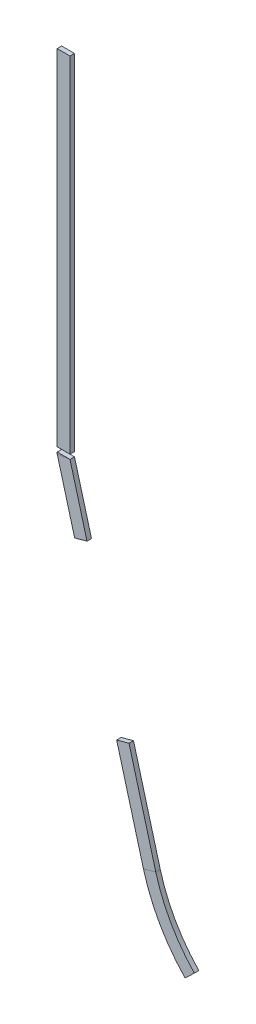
SolidWorks part; units mm, degrees
ref_plane "Front Plane" through (0, 0, 0) normal (0, 0, 1) x (1, 0, 0)
ref_plane "Top Plane" through (0, 0, 0) normal (0, 1, 0) x (1, 0, 0)
ref_plane "Right Plane" through (0, 0, 0) normal (1, 0, 0) x (0, 0, -1)
sketch "Sketch2" plane through (0, 0, 0) normal (0, 0, 1) x (1, 0, 0)
  line L1 (-319.8736, 461.9467) -> (162.5, 593.5358) construction
  line L2 (162.5, 593.5358) -> (-199.7611, 248.9101) construction
  line L3 (-607.5, 2533) -> (-607.5, 1440.321)
  line L4 (-607.5, 1440.321) -> (-339.1686, 456.6832)
  line L7 (-587.5, 2533) -> (-587.5, 1443) construction
  line L8 (-587.5, 1443) -> (-319.8736, 461.9467) construction
  line L10 (-14.3367, 29.5909) -> (-214.1744, 235.0439) construction
  line L11 (0, 43.5358) -> (-199.7611, 248.9101) construction
  arc A0 (-339.1686, 456.6832) -> (-214.1744, 235.0439) centre (162.5, 593.5358) ccw
  arc A1 (-319.8736, 461.9467) -> (-199.7611, 248.9101) centre (162.5, 593.5358) ccw construction
  point P0 (-339.1686, 456.6832)
  dimension "D2" = 1016.9019
  dimension "D4" = 28.312
  dimension "D1" = 1440.321
  dimension "D5" = 593.5358
  dimension "D6" = 164.741
  dimension "D3" = 1090
  dimension "D8" = 587.5
  dimension "D9" = 20
ref_plane "Plane1" through (-607.5, 2533, 0) normal (0, -1, 0) x (-1, 0, 0)
sketch "Sketch3" plane through (-607.5, 2533, 0) normal (0, -1, 0) x (-1, 0, 0)
  line L1 (-20, 7) -> (20, 7)
  line L2 (-20, 7) -> (-20, -7)
  line L3 (-20, -7) -> (20, -7)
  line L4 (20, 7) -> (20, -7)
  line L5 (-20, 7) -> (20, -7) construction
  line L6 (-20, -7) -> (20, 7) construction
  point P0 (0, 0)
  dimension "D1" = 40
  dimension "D2" = 14
sweep "Sweep1" add profiles "Sketch3" path "Sketch2"
sketch "Sketch4" plane through (-219.0197, -59.7475, 0) normal (-0.9647, -0.2632, 0) x (0, 0, 1)
  line L1 (-7, 1552.1055) -> (-7, 529.8456) construction
  line L2 (-21, 847.2117) -> (7, 847.2117)
  line L3 (-21, 847.2117) -> (-21, 1345.2117)
  line L4 (-21, 1345.2117) -> (7, 1345.2117)
  line L5 (7, 847.2117) -> (7, 1345.2117)
  line L6 (-21, 847.2117) -> (7, 1345.2117) construction
  line L7 (-21, 1345.2117) -> (7, 847.2117) construction
  line L9 (7, 1552.1055) -> (7, 529.8456) construction
  line L11 (-249, 847.2117) -> (249, 847.2117) construction
  point P0 (-7, 1096.2117)
  dimension "D1" = 498
extrude "Cut-Extrude1" cut sketch "Sketch4" against normal blind 40
sketch "Sketch5" plane through (0, 0, 7) normal (0, 0, 1) x (1, 0, 0)
  line L0 (-587.5, 1443) -> (-627.5, 1443)
  line L1 (-627.5, 1443) -> (-627.5, 1457)
  line L2 (-627.5, 1457) -> (-587.5, 1457)
  line L3 (-587.5, 2533) -> (-587.5, 1443) construction
  line L4 (-587.5, 1457) -> (-587.5, 1443)
  line L5 (-627.5, 2533) -> (-627.5, 1437.642) construction
  line L6 (952.5, 1457) -> (-627.5, 1457) construction
  point P7 (-627.5, 1443)
  point P10 (-587.5, 1456.8036)
extrude "Cut-Extrude2" cut sketch "Sketch5" against normal up to surface (14 mm away) contours L0 L1 L2 L4
